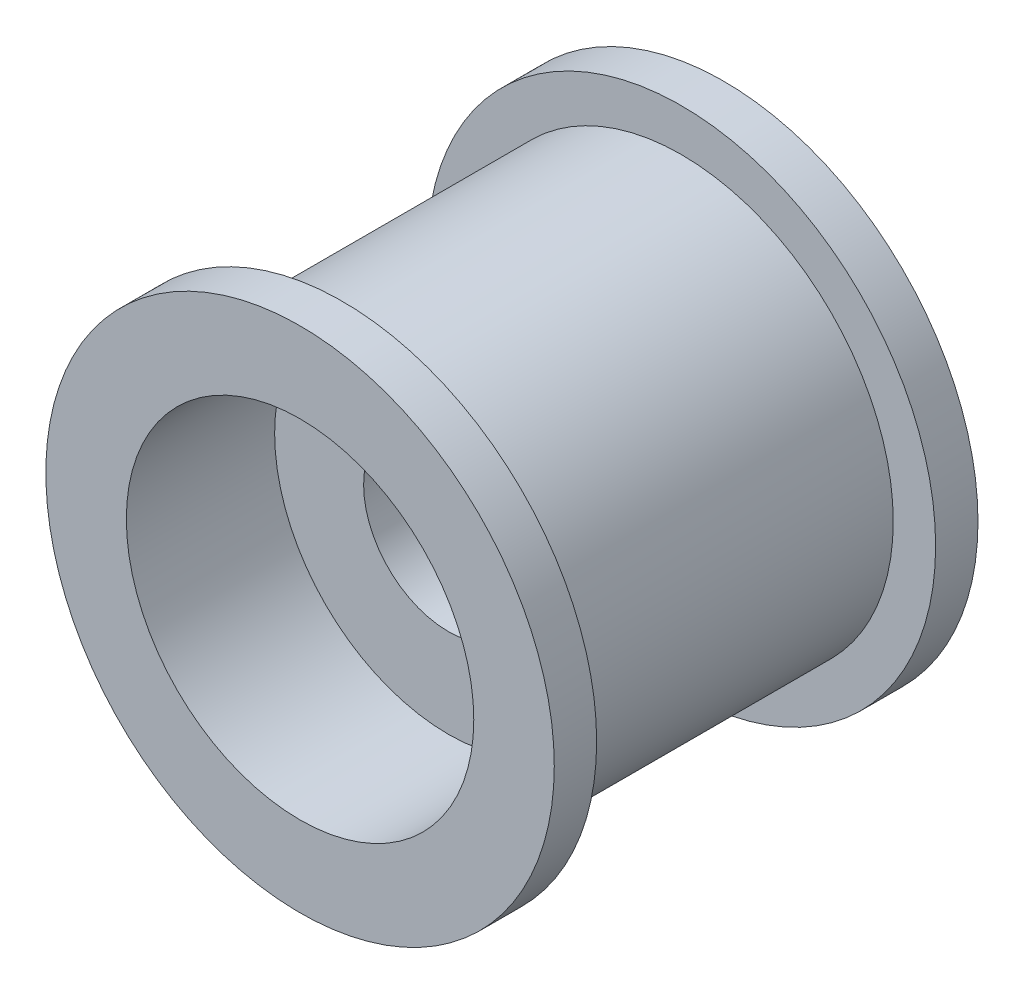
SolidWorks part; units mm, degrees
ref_plane "前视基准面" through (0, 0, 0) normal (0, 0, 1) x (1, 0, 0)
ref_plane "上视基准面" through (0, 0, 0) normal (0, 1, 0) x (1, 0, 0)
ref_plane "右视基准面" through (0, 0, 0) normal (1, 0, 0) x (0, 0, -1)
sketch "草图1" plane through (0, 0, 0) normal (0, 0, 1) x (1, 0, 0)
  circle A0 centre (0, 0) radius 6
  dimension "D1" = 12
extrude "凸台-拉伸1" add sketch "草图1" along normal blind 10
sketch "草图2" plane through (0, 0, 10) normal (0, 0, 1) x (1, 0, 0)
  circle A0 centre (0, 0) radius 6
  circle A1 centre (0, 0) radius 5
  dimension "D1" = 10
extrude "切除-拉伸1" cut sketch "草图2" against normal blind 8 from offset 1
sketch "草图3" plane through (0, 0, 10) normal (0, 0, 1) x (1, 0, 0)
  circle A0 centre (0, 0) radius 4.1
  dimension "D1" = 8.2
extrude "切除-拉伸2" cut sketch "草图3" against normal blind 3.5
ref_plane "基准面1" through (0, 0, 5) normal (0, 0, 1) x (1, 0, 0)
mirror "镜向1" about plane through (0, 0, 5) normal (0, 0, 1) of "切除-拉伸2"
sketch "草图4" plane through (0, 0, 3.5) normal (0, 0, -1) x (-1, 0, 0)
  circle A0 centre (0, 0) radius 2
  dimension "D1" = 4
extrude "切除-拉伸3" cut sketch "草图4" against normal through all
